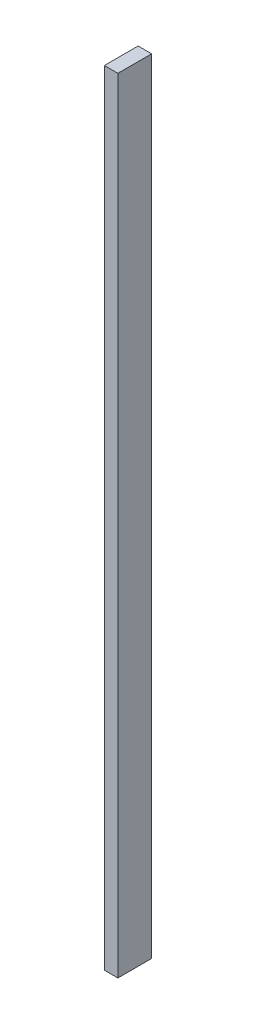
SolidWorks part; units mm, degrees
ref_plane "Plan de face" through (0, 0, 0) normal (0, 0, 1) x (1, 0, 0)
ref_plane "Plan de dessus" through (0, 0, 0) normal (0, 1, 0) x (1, 0, 0)
ref_plane "Plan de droite" through (0, 0, 0) normal (1, 0, 0) x (0, 0, -1)
sketch "Esquisse1" plane through (0, 0, 0) normal (0, 1, 0) x (1, 0, 0)
  line L1 (0, 0) -> (20, 0)
  line L2 (0, 0) -> (0, 50)
  line L3 (0, 50) -> (20, 50)
  line L4 (20, 0) -> (20, 50)
  dimension "D1" = 20
  dimension "D2" = 50
extrude "Extrusion1" add sketch "Esquisse1" along normal blind 1160
